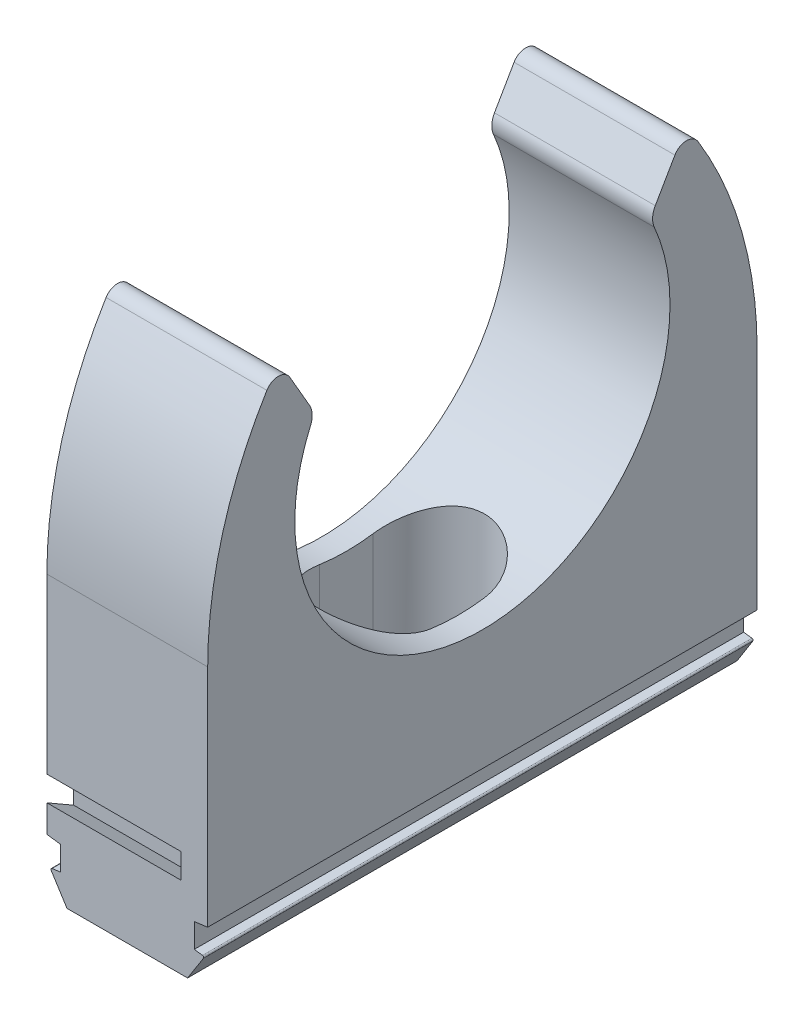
SolidWorks part; units mm, degrees
ref_plane "Ebene vorne" through (0, 0, 0) normal (0, 0, 1) x (1, 0, 0)
ref_plane "Ebene oben" through (0, 0, 0) normal (0, 1, 0) x (1, 0, 0)
ref_plane "Ebene rechts" through (0, 0, 0) normal (1, 0, 0) x (0, 0, -1)
sketch "Skizze1" plane through (0, 0, 0) normal (1, 0, 0) x (0, 0, -1)
  line L0 (20.5, -27) -> (-20.5, -27)
  line L1 (-20.5, -27) -> (-20.5, -6.1447)
  line L2 (-14.3653, 9.5) -> (-12.901, 6.9637)
  line L3 (0, 33.9422) -> (0, -46.7435) construction
  line L4 (14.3653, 9.5) -> (12.901, 6.9637)
  line L5 (20.5, -27) -> (20.5, -6.1447)
  arc A0 (-12.8258, 5.6124) -> (12.8258, 5.6124) centre (0, 0) ccw
  arc A1 (-20.5, -6.1447) -> (-16.0841, 9.5222) centre (9.5, -6.1447) cw
  arc A2 (-16.0841, 9.5222) -> (-14.3653, 9.5) centre (-15.2313, 9) cw
  arc A3 (-12.901, 6.9637) -> (-12.8258, 5.6124) centre (-14.2, 6.2137) cw
  arc A4 (12.901, 6.9637) -> (12.8258, 5.6124) centre (14.2, 6.2137) ccw
  arc A5 (16.0841, 9.5222) -> (14.3653, 9.5) centre (15.2313, 9) ccw
  arc A6 (20.5, -6.1447) -> (16.0841, 9.5222) centre (-9.5, -6.1447) ccw
  point P23 (0, -27)
  dimension "D1" = 28
  dimension "D5" = 1
  dimension "D6" = 1.5
  dimension "D7" = 25.4
  dimension "D9" = 30
  dimension "D2" = 41
  dimension "D3" = 30
  dimension "D4" = 27
  dimension "D8" = 37
extrude "Linear austragen1" add sketch "Skizze1" against normal mid plane 12
sketch "Skizze11" plane through (0, 0, 0) normal (0, 1, 0) x (1, 0, 0)
  line L2 (-4.15, 2) -> (-4.15, -2)
  line L4 (4.15, 2) -> (4.15, -2)
  line L5 (-4.15, 0) -> (4.15, 0) construction
  line L6 (0, 5) -> (0, -5) construction
  arc A4 (-4.15, 2) -> (4.15, 2) centre (0, 2) cw
  arc A5 (-4.15, -2) -> (4.15, -2) centre (0, -2) ccw
  dimension "D1" = 4
  dimension "D2" = 8.3
extrude "Schnitt-Linear austragen6" cut sketch "Skizze11" against normal offset from surface (21.5 mm away) 5.5
sketch "Skizze12" plane through (0, -27, 0) normal (0, -1, 0) x (1, 0, 0)
  line L0 (-2.5, -1.25) -> (-2.5, 1.25)
  line L1 (2.5, 1.25) -> (2.5, -1.25)
  line L2 (2.5, 0) -> (-2.5, 0) construction
  arc A0 (-2.5, 1.25) -> (2.5, 1.25) centre (0, 1.25) cw
  arc A1 (2.5, -1.25) -> (-2.5, -1.25) centre (0, -1.25) cw
  dimension "D2" = 7.5
  dimension "D1" = 5
extrude "Schnitt-Linear austragen7" cut sketch "Skizze12" against normal up to next
sketch "Skizze16" plane through (0, 0, 0) normal (0, 0, 1) x (1, 0, 0)
  line L0 (6, -27) -> (6, -22.9683)
  line L1 (0, -27) -> (0, -19.7249) construction
  line L2 (-6, -27) -> (6, -27) construction
  line L3 (-6, -6.1447) -> (-6, -27) construction
  line L4 (-6, -22.9683) -> (-5, -23.1)
  line L5 (-5, -23.1) -> (-5, -24.9)
  line L6 (-5, -24.9) -> (-5.6131, -24.9807)
  line L7 (-5.6844, -25.1334) -> (-4.5, -27)
  line L8 (-4.5, -27) -> (-6, -27)
  line L9 (-6, -27) -> (-6, -22.9683)
  line L10 (-5, -24) -> (-6.4864, -24) construction
  line L11 (4.5, -27) -> (6, -27)
  line L12 (5.6844, -25.1334) -> (4.5, -27)
  line L13 (5, -24.9) -> (5.6131, -24.9807)
  line L14 (5, -23.1) -> (5, -24.9)
  line L15 (6, -22.9683) -> (5, -23.1)
  arc A0 (-5.6131, -24.9807) -> (-5.6844, -25.1334) centre (-5.6, -25.0799) ccw
  arc A1 (5.6131, -24.9807) -> (5.6844, -25.1334) centre (5.6, -25.0799) cw
  dimension "D6" = 0.1
  dimension "D7" = 11.4
  dimension "D1" = 15
  dimension "D2" = 1.8
  dimension "D3" = 10
  dimension "D4" = 9
  dimension "D5" = 3
extrude "Schnitt-Linear austragen9" cut sketch "Skizze16" against normal up to next and the other way up to next
sketch "Skizze15" plane through (-6, 0, 0) normal (-1, 0, 0) x (0, 0, 1)
  line L0 (-20.5, -19) -> (-20.5, -21)
  line L1 (-20.5, -22.9683) -> (-20.5, -6.1447) construction
  line L2 (-20.5, -19) -> (-22.5, -17.8453)
  line L3 (-22.5, -17.8453) -> (-22.5, -22.1547)
  line L4 (-22.5, -20) -> (-20.5, -20) construction
  line L6 (-20.5, -21) -> (-22.5, -22.1547)
  line L8 (20.5, -27) -> (-20.5, -27) construction
  dimension "D1" = 60
  dimension "D2" = 2
  dimension "D4" = 2
  dimension "D5" = 7
extrude "Linear austragen6" add sketch "Skizze15" against normal blind 10
sketch "Skizze20" plane through (-6, 0, 0) normal (-1, 0, 0) x (0, 0, 1)
  line L0 (-22.5, -20) -> (20.5, -20) construction
  line L1 (-22.5, -17.8453) -> (-22.5, -22.1547) construction
  line L2 (20.5, -6.1447) -> (20.5, -22.9683) construction
  line L4 (20.5, -19.0732) -> (18.5, -17.9185)
  line L5 (18.5, -17.9185) -> (18.5, -22.0815)
  line L6 (20.5, -20.9268) -> (18.5, -22.0815)
  line L7 (20.5, -19.0732) -> (20.5, -20.9268)
  arc A0 (20.5, -18.9) -> (20.35, -18.9866) centre (20.4, -18.9) cw construction
  arc A1 (20.5, -21.1) -> (20.35, -21.0134) centre (20.4, -21.1) ccw construction
  point P11 (18.5, -20)
  point P14 (20.5, -17.1402)
  dimension "D1" = 0.1
  dimension "D4" = 2
  dimension "D2" = 2
  dimension "D3" = 60
extrude "Schnitt-Linear austragen10" cut sketch "Skizze20" against normal blind 10
